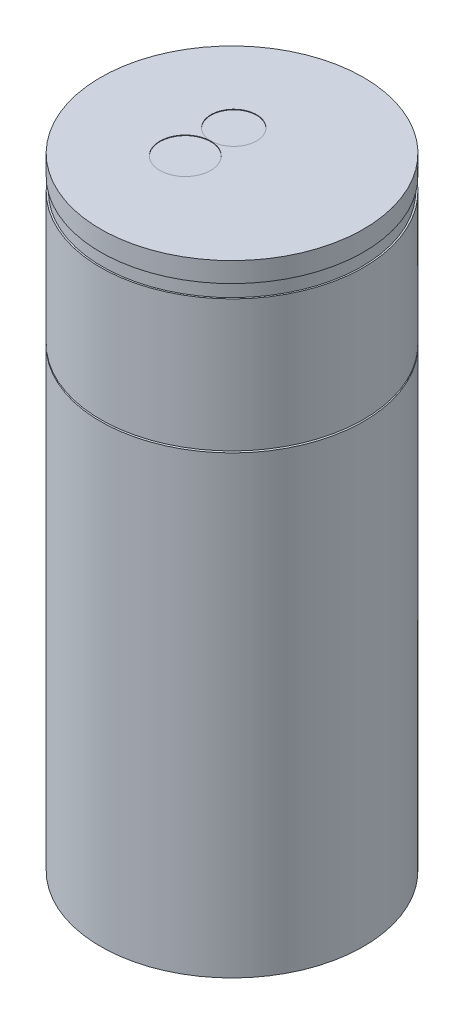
SolidWorks part; units mm, degrees
ref_plane "Front" through (0, 0, 0) normal (0, 0, 1) x (1, 0, 0)
ref_plane "Top" through (0, 0, 0) normal (0, 1, 0) x (1, 0, 0)
ref_plane "Right" through (0, 0, 0) normal (1, 0, 0) x (0, 0, -1)
sketch "Sketch1" plane through (0, 0, 0) normal (0, 0, 1) x (1, 0, 0)
  line L0 (0, -34.5932) -> (0, 100.349) construction
  line L1 (0, 148.844) -> (-31.496, 148.844)
  line L2 (-31.496, 148.844) -> (-31.496, 144.0688)
  line L3 (-31.496, 144.0688) -> (-31.115, 144.0688)
  line L4 (-31.115, 144.0688) -> (-31.115, 140.8938)
  line L5 (-31.115, 140.8938) -> (-31.496, 140.8938)
  line L6 (-31.496, 140.8938) -> (-31.496, 109.347)
  line L7 (-31.496, 109.347) -> (-25.146, 109.347)
  line L8 (-25.146, 109.347) -> (-25.146, 108.9406)
  line L9 (-25.146, 108.9406) -> (-31.496, 108.9406)
  line L10 (-31.496, 108.9406) -> (-31.496, 0)
  line L11 (-31.496, 0) -> (0, 0)
  line L12 (0, 0) -> (0, 148.844)
  dimension "D1" = 148.844
  dimension "D2" = 4.7752
  dimension "D3" = 3.175
  dimension "D4" = 39.497
  dimension "D5" = 0.4064
  dimension "D6" = 6.35
  dimension "D11" = 62.992
  dimension "D12" = 62.23
revolve "Revolve1" add sketch "Sketch1" angle 360 about L0
sketch "Sketch2" plane through (0, 148.844, 0) normal (0, 1, 0) x (1, 0, 0)
  line L0 (0, 0) -> (-42.0563, 0) construction
  line L1 (-5.08, 5.4864) -> (-5.08, -6.1214) construction
  circle A0 centre (-5.08, 5.4864) radius 5.461
  circle A1 centre (-5.08, -6.1214) radius 6.096
  dimension "D1" = 10.922
  dimension "D2" = 12.192
  dimension "D5" = 0.0254
  dimension "D3" = 5.08
  dimension "D4" = 0.0254
extrude "Cut-Extrude1" cut sketch "Sketch2" against normal blind 0.127
